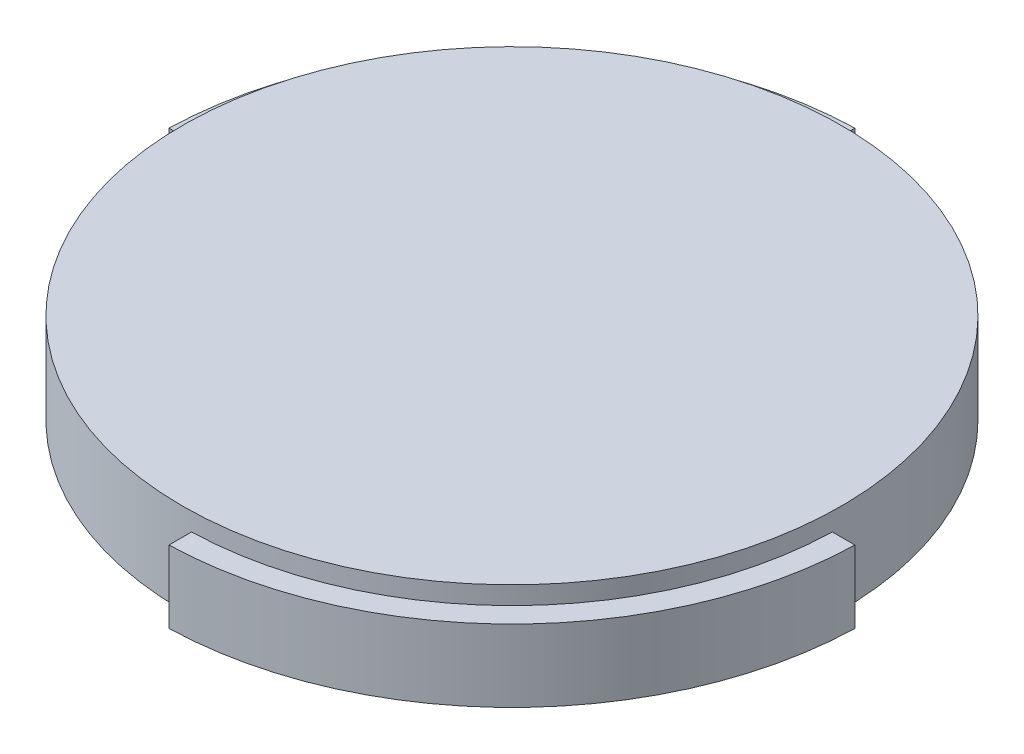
SolidWorks part; units mm, degrees
ref_plane "Alzado" through (0, 0, 0) normal (0, 0, 1) x (1, 0, 0)
ref_plane "Planta" through (0, 0, 0) normal (0, 1, 0) x (1, 0, 0)
ref_plane "Vista lateral" through (0, 0, 0) normal (1, 0, 0) x (0, 0, -1)
sketch "Croquis1" plane through (0, 0, 0) normal (0, 1, 0) x (1, 0, 0)
  circle A0 centre (0, 0) radius 39
extrude "Saliente-Extruir1" add sketch "Croquis1" along normal blind 10
sketch "Croquis2" plane through (0, 10, 0) normal (0, 1, 0) x (1, 0, 0)
  line L0 (0, 39) -> (0, -39) construction
  line L1 (39, 0) -> (-39, 0) construction
  line L4 (-1, 38.9872) -> (-1, 36.4863)
  line L5 (-36.4863, 0.9999) -> (-38.9872, 0.9999)
  line L7 (38.9872, -1) -> (36.4863, -1)
  line L9 (1, -38.9872) -> (1, -36.4863)
  circle A0 centre (0, 0) radius 39 construction
  arc A1 (1, -36.4863) -> (36.4863, -1) centre (0, 0) ccw
  arc A2 (1, -38.9872) -> (38.9872, -1) centre (0, 0) ccw
  arc A3 (-1, 36.4863) -> (-36.4863, 0.9999) centre (0, 0) ccw
  arc A4 (-1, 38.9872) -> (-38.9872, 0.9999) centre (0, 0) ccw
extrude "Cortar-Extruir1" cut sketch "Croquis2" against normal blind 2
sketch "Croquis3" plane through (0, 10, 0) normal (0, 1, 0) x (1, 0, 0)
  line L0 (-1, 38.9872) -> (-1, 36.4863)
  line L1 (-36.4863, 0.9999) -> (-38.9872, 0.9999)
  line L2 (1, -36.4863) -> (1, -38.9872)
  line L3 (38.9872, -1) -> (36.4863, -1)
  arc A0 (-36.4863, 0.9999) -> (1, -36.4863) centre (0, 0) ccw
  arc A1 (-38.9872, 0.9999) -> (1, -38.9872) centre (0, 0) ccw
  arc A2 (36.4863, -1) -> (-1, 36.4863) centre (0, 0) ccw
  arc A3 (38.9872, -1) -> (-1, 38.9872) centre (0, 0) ccw
extrude "Cortar-Extruir2" cut sketch "Croquis3" against normal blind 10
